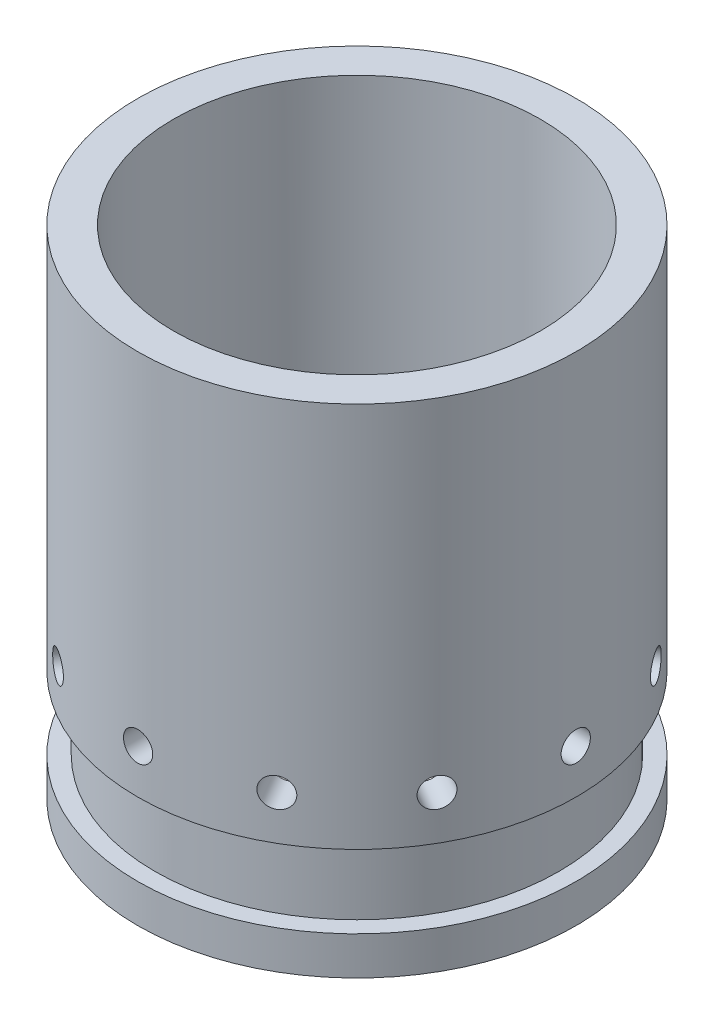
SolidWorks part; units mm, degrees
ref_plane "Front Plane" through (0, 0, 0) normal (0, 0, 1) x (1, 0, 0)
ref_plane "Top Plane" through (0, 0, 0) normal (0, 1, 0) x (1, 0, 0)
ref_plane "Right Plane" through (0, 0, 0) normal (1, 0, 0) x (0, 0, -1)
sketch "Sketch1" plane through (0, 0, 0) normal (0, 1, 0) x (1, 0, 0)
  circle A0 centre (0, 0) radius 15.9385
  circle A1 centre (0, 0) radius 19.05
  dimension "D1" = 31.877
  dimension "D2" = 38.1
extrude "MainBody" add sketch "Sketch1" along normal blind 43.18
sketch "Sketch2" plane through (0, 0, 0) normal (0, 0, 1) x (1, 0, 0)
  line L0 (0, 13.5) -> (0, 0) construction
  circle A0 centre (0, 13.5) radius 1.27
  dimension "D1" = 2.54
  dimension "D2" = 13.5
extrude "ReleaseHole" cut sketch "Sketch2" against normal blind 43.18
pattern_circular "ReleaseHolesPattern" count 12 every 30 about axis through (0, 43.18, 0) along (0, -1, 0) of "ReleaseHole"
sketch "Sketch3" plane through (0, 0, 0) normal (0, 0, 1) x (1, 0, 0)
  line L0 (19.05, 9.675) -> (17.55, 9.675)
  line L1 (19.05, 0) -> (19.05, 12.23) construction
  line L2 (17.55, 9.675) -> (17.55, 3.325)
  line L3 (17.55, 3.325) -> (19.05, 3.325)
  line L4 (19.05, 0) -> (19.05, 12.23) construction
  line L12 (19.05, 0) -> (19.05, 12.23) construction
  line L26 (19.05, 0) -> (19.05, 12.23) construction
  line L34 (-19.05, 0) -> (19.05, 0) construction
  line L35 (19.05, 9.675) -> (19.05, 3.325)
  point P24 (17.55, 6.5)
  dimension "D1" = 1.5
  dimension "D2" = 6.35
  dimension "D3" = 6.5
ref_axis "Axis1" through (0, 43.18, 0) along (0, -1, 0)
revolve "Cut-Revolve1" cut sketch "Sketch3" angle 360 about axis through (0, 43.18, 0) along (0, -1, 0)
